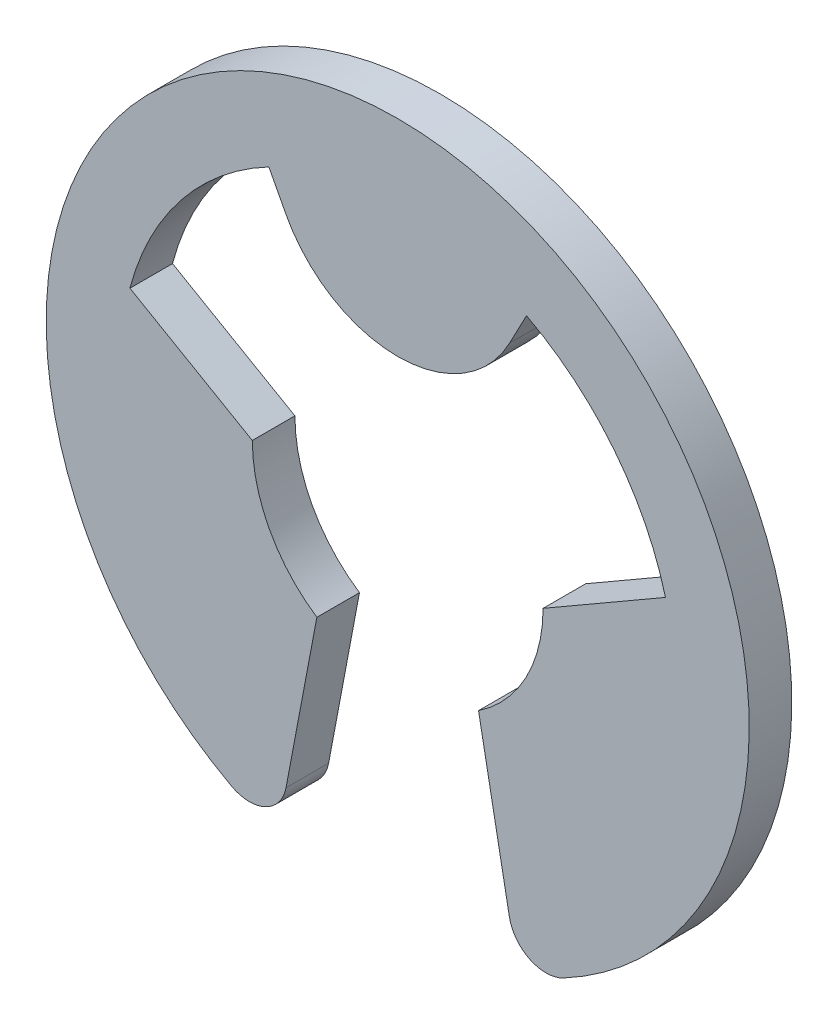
SolidWorks part; units mm, degrees
ref_plane "Face" through (0, 0, 0) normal (0, 0, 1) x (1, 0, 0)
ref_plane "Dessus" through (0, 0, 0) normal (0, 1, 0) x (1, 0, 0)
ref_plane "Droite" through (0, 0, 0) normal (1, 0, 0) x (0, 0, -1)
sketch "Esquisse1" plane through (0, 0, 0) normal (0, 0, 1) x (1, 0, 0)
  line L0 (1.0508, 1.9999) -> (1.2093, 2.3016)
  line L1 (-1.365, 0) -> (-2.514, 0.6633)
  line L2 (0, 3.15) -> (0, -2.9093) construction
  line L3 (-0.7589, -1.1346) -> (-1.0484, -2.6658)
  line L4 (-1.0508, 1.9999) -> (-1.2093, 2.3016)
  line L6 (0.7589, -1.1346) -> (1.0484, -2.6658)
  line L7 (1.365, 0) -> (2.514, 0.6633)
  arc A0 (2.514, 0.6633) -> (1.2093, 2.3016) centre (0, 0) ccw
  arc A1 (-0.7589, -1.1346) -> (-1.365, 0) centre (0, 0) cw
  arc A2 (1.5575, -2.9093) -> (-1.5575, -2.9093) centre (0, 0) ccw
  arc A3 (-1.0484, -2.6658) -> (-1.5575, -2.9093) centre (-1.3923, -2.6008) cw
  arc A4 (-2.514, 0.6633) -> (-1.2093, 2.3016) centre (0, 0) cw
  arc A5 (1.0484, -2.6658) -> (1.5575, -2.9093) centre (1.3923, -2.6008) ccw
  arc A6 (0.7589, -1.1346) -> (1.365, 0) centre (0, 0) ccw
  arc A7 (-1.0508, 1.9999) -> (1.0508, 1.9999) centre (0, 2.552) ccw
  circle A8 centre (0, 0) radius 1.365 construction
  point P16 (0, 1.365)
  dimension "D1" = 3.3
  dimension "D2" = 2.6
  dimension "D3" = 1.365
  dimension "D7" = 0.35
  dimension "D4" = 27.718
  dimension "D5" = 10.706
  dimension "D6" = 60
  dimension "D9" = 1.5178
extrude "Extrusion1" add sketch "Esquisse1" along normal blind 0.4
